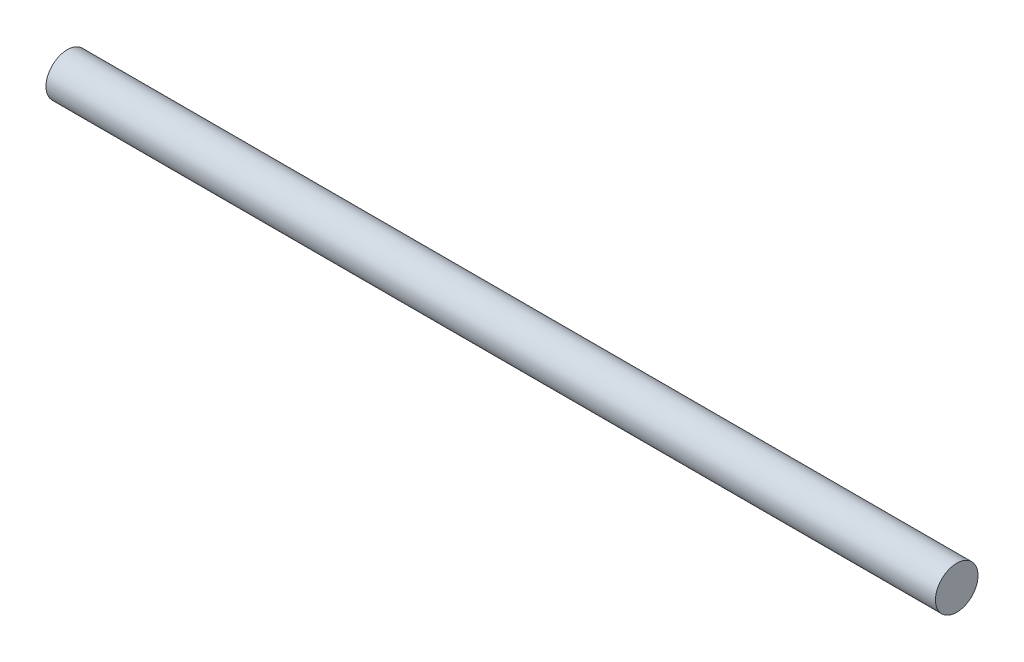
SolidWorks part; units mm, degrees
ref_plane "Front Plane" through (0, 0, 0) normal (0, 0, 1) x (1, 0, 0)
ref_plane "Top Plane" through (0, 0, 0) normal (0, 1, 0) x (1, 0, 0)
ref_plane "Right Plane" through (0, 0, 0) normal (1, 0, 0) x (0, 0, -1)
sketch "Sketch1" plane through (0, 0, 0) normal (0, 0, 1) x (1, 0, 0)
  line L0 (0, 0) -> (0, 2.5525)
  line L1 (0, 2.5525) -> (106.68, 2.5525)
  line L2 (106.68, 2.5525) -> (106.68, 0)
  line L3 (106.68, 0) -> (0, 0)
  line L4 (106.68, 0) -> (0, 0) construction
  dimension "D1" = 2.5525
  dimension "D2" = 106.68
revolve "Revolve1" add sketch "Sketch1" angle 360 about L4
